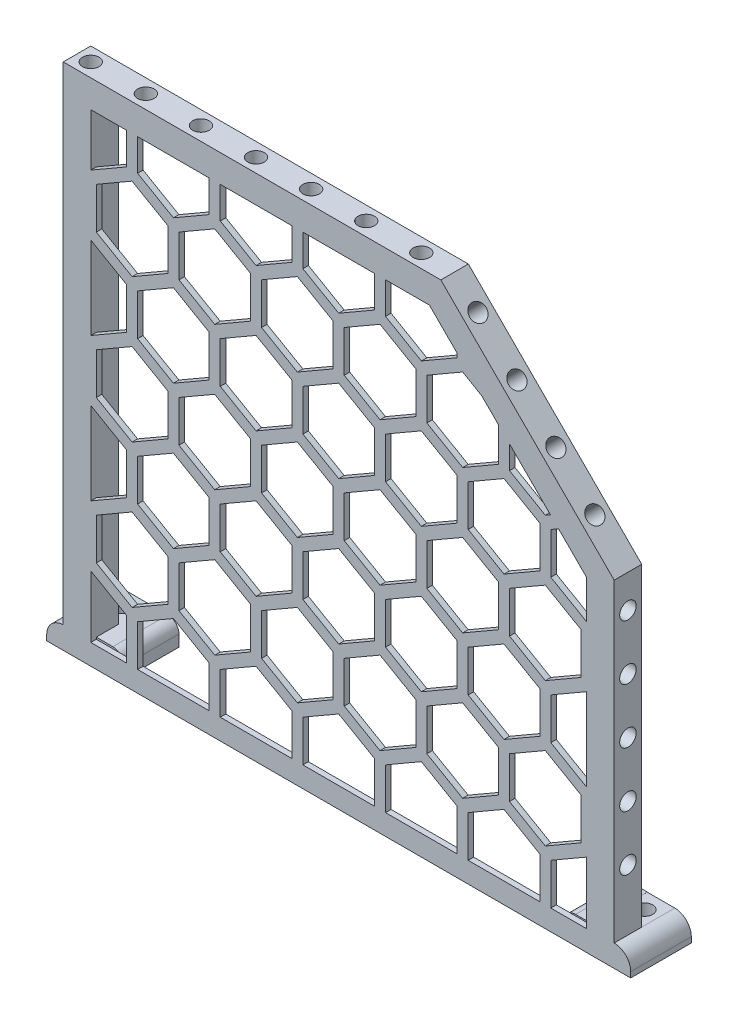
SolidWorks part; units mm, degrees
ref_plane "Plano frontal" through (0, 0, 0) normal (0, 0, 1) x (1, 0, 0)
ref_plane "Plano superior" through (0, 0, 0) normal (0, 1, 0) x (1, 0, 0)
ref_plane "Plano direito" through (0, 0, 0) normal (1, 0, 0) x (0, 0, -1)
sketch "Esboço1" plane through (0, 0, 0) normal (0, 0, 1) x (1, 0, 0)
  line L0 (-116.1394, 59.0665) -> (-116.1394, 68.5721)
  line L1 (-107.6394, 68.5721) -> (-94.6394, 68.5721)
  line L2 (-92.6394, 68.5721) -> (-79.6394, 68.5721)
  line L3 (-119.3883, -18.9279) -> (-24.3883, -18.9279) construction
  line L4 (-77.6394, 68.5721) -> (-64.6394, 68.5721)
  line L5 (-62.6394, 68.5721) -> (-54.6749, 68.5721)
  line L6 (-26.1394, 22.0777) -> (-26.1394, 7.0665)
  line L7 (-26.1394, -3.9223) -> (-26.1394, -15.1807)
  line L8 (-116.1394, -15.1807) -> (-116.1394, -3.9223)
  line L9 (-116.1394, 68.5721) -> (-109.6394, 68.5721)
  line L10 (-54.6749, 68.5721) -> (-49.6394, 63.5366)
  line L11 (-26.1394, 40.0366) -> (-26.1394, 33.0665)
  line L12 (-121.1394, -18.9279) -> (-121.1394, 73.5721)
  line L13 (-121.1394, 73.5721) -> (-52.6039, 73.5721)
  line L14 (-52.6039, 73.5721) -> (-21.1394, 42.1076)
  line L15 (-21.1394, 42.1076) -> (-21.1394, -18.9279)
  line L16 (-121.1394, -18.9279) -> (-116.1394, -18.9279)
  line L17 (-26.1394, -18.9279) -> (-21.1394, -18.9279)
  line L18 (-26.1394, -3.9223) -> (-26.1394, -15.1807)
  line L19 (-26.1394, -18.9279) -> (-26.1394, -18.9335)
  line L20 (-116.1394, 7.0665) -> (-116.1394, 22.0777)
  line L21 (-116.1394, 33.0665) -> (-116.1394, 48.0777)
  line L22 (-31.2372, 45.1344) -> (-26.1394, 40.0366)
  line L23 (-40.1394, 54.0366) -> (-32.7074, 46.6046)
  line L24 (-45.1876, 59.0847) -> (-42.1394, 56.0366)
  line L60 (-116.149, -18.9279) -> (-26.149, -18.9279)
  line L62 (-116.1394, 68.5721) -> (-109.6394, 68.5721)
  line L63 (-93.6394, -5.9335) -> (-87.1394, -2.1807)
  line L64 (-108.6394, -5.9335) -> (-102.1394, -2.1807)
  line L65 (-102.1394, -2.1807) -> (-102.1394, 5.3249)
  line L66 (-54.6749, 68.5721) -> (-49.6394, 63.5366)
  line L67 (-101.1394, 22.0777) -> (-107.6394, 18.3249)
  line L68 (-116.149, -18.9279) -> (-116.1394, -18.9335)
  line L69 (-26.1394, 40.0366) -> (-26.1394, 33.0665)
  line L70 (-26.1394, -18.9335) -> (-116.149, -18.9279)
  line L71 (-116.1394, 7.0665) -> (-109.6394, 10.8193)
  line L72 (-101.1394, -18.9335) -> (-101.1298, -18.9279)
  line L73 (-116.1394, -18.9335) -> (-116.1298, -18.9279)
  line L74 (-109.6394, -15.1807) -> (-109.6394, -7.6751)
  line L75 (-109.6394, -7.6751) -> (-116.1394, -3.9223)
  line L76 (-116.1394, -15.1807) -> (-109.6394, -15.1807)
  line L77 (-107.6394, -15.1807) -> (-94.6394, -15.1807)
  line L78 (-92.6394, -15.1807) -> (-79.6394, -15.1807)
  line L79 (-94.6394, -15.1807) -> (-94.6394, -7.6751)
  line L80 (-94.6394, -7.6751) -> (-101.1394, -3.9223)
  line L81 (-101.1394, -3.9223) -> (-107.6394, -7.6751)
  line L82 (-107.6394, -7.6751) -> (-107.6394, -15.1807)
  line L83 (-101.149, -18.9279) -> (-101.1394, -18.9335)
  line L84 (-86.1394, -18.9335) -> (-86.1298, -18.9279)
  line L85 (-79.6394, -15.1807) -> (-79.6394, -7.6751)
  line L86 (-79.6394, -7.6751) -> (-86.1394, -3.9223)
  line L87 (-86.1394, -3.9223) -> (-92.6394, -7.6751)
  line L88 (-92.6394, -7.6751) -> (-92.6394, -15.1807)
  line L89 (-86.149, -18.9279) -> (-86.1394, -18.9335)
  line L90 (-71.1394, -18.9335) -> (-71.1298, -18.9279)
  line L91 (-64.6394, -15.1807) -> (-64.6394, -7.6751)
  line L92 (-64.6394, -7.6751) -> (-71.1394, -3.9223)
  line L93 (-71.1394, -3.9223) -> (-77.6394, -7.6751)
  line L94 (-77.6394, -7.6751) -> (-77.6394, -15.1807)
  line L95 (-71.149, -18.9279) -> (-71.1394, -18.9335)
  line L96 (-56.1394, -18.9335) -> (-56.1298, -18.9279)
  line L97 (-49.6394, -15.1807) -> (-49.6394, -7.6751)
  line L98 (-49.6394, -7.6751) -> (-56.1394, -3.9223)
  line L99 (-56.1394, -3.9223) -> (-62.6394, -7.6751)
  line L100 (-62.6394, -7.6751) -> (-62.6394, -15.1807)
  line L101 (-56.149, -18.9279) -> (-56.1394, -18.9335)
  line L102 (-41.1394, -18.9335) -> (-41.1298, -18.9279)
  line L103 (-34.6394, -15.1807) -> (-34.6394, -7.6751)
  line L104 (-34.6394, -7.6751) -> (-41.1394, -3.9223)
  line L105 (-41.1394, -3.9223) -> (-47.6394, -7.6751)
  line L106 (-47.6394, -7.6751) -> (-47.6394, -15.1807)
  line L107 (-41.149, -18.9279) -> (-41.1394, -18.9335)
  line L108 (-26.1394, -18.9335) -> (-26.1298, -18.9279)
  line L109 (-77.6394, -15.1807) -> (-64.6394, -15.1807)
  line L110 (-62.6394, -15.1807) -> (-49.6394, -15.1807)
  line L111 (-26.1394, -3.9223) -> (-32.6394, -7.6751)
  line L112 (-32.6394, -7.6751) -> (-32.6394, -15.1807)
  line L113 (-26.149, -18.9279) -> (-26.1394, -18.9335)
  line L114 (-102.1394, 5.3249) -> (-108.6394, 9.0777)
  line L115 (-108.6394, 9.0777) -> (-115.1394, 5.3249)
  line L116 (-115.1394, 5.3249) -> (-115.1394, -2.1807)
  line L117 (-115.1394, -2.1807) -> (-108.6394, -5.9335)
  line L118 (-87.1394, -2.1807) -> (-87.1394, 5.3249)
  line L119 (-87.1394, 5.3249) -> (-93.6394, 9.0777)
  line L120 (-93.6394, 9.0777) -> (-100.1394, 5.3249)
  line L121 (-100.1394, 5.3249) -> (-100.1394, -2.1807)
  line L122 (-100.1394, -2.1807) -> (-93.6394, -5.9335)
  line L123 (-78.6394, -5.9335) -> (-72.1394, -2.1807)
  line L124 (-72.1394, -2.1807) -> (-72.1394, 5.3249)
  line L125 (-72.1394, 5.3249) -> (-78.6394, 9.0777)
  line L126 (-78.6394, 9.0777) -> (-85.1394, 5.3249)
  line L127 (-85.1394, 5.3249) -> (-85.1394, -2.1807)
  line L128 (-85.1394, -2.1807) -> (-78.6394, -5.9335)
  line L129 (-63.6394, -5.9335) -> (-57.1394, -2.1807)
  line L130 (-57.1394, -2.1807) -> (-57.1394, 5.3249)
  line L131 (-57.1394, 5.3249) -> (-63.6394, 9.0777)
  line L132 (-63.6394, 9.0777) -> (-70.1394, 5.3249)
  line L133 (-70.1394, 5.3249) -> (-70.1394, -2.1807)
  line L134 (-70.1394, -2.1807) -> (-63.6394, -5.9335)
  line L135 (-48.6394, -5.9335) -> (-42.1394, -2.1807)
  line L136 (-42.1394, -2.1807) -> (-42.1394, 5.3249)
  line L137 (-42.1394, 5.3249) -> (-48.6394, 9.0777)
  line L138 (-48.6394, 9.0777) -> (-55.1394, 5.3249)
  line L139 (-55.1394, 5.3249) -> (-55.1394, -2.1807)
  line L140 (-55.1394, -2.1807) -> (-48.6394, -5.9335)
  line L141 (-33.6394, -5.9335) -> (-27.1394, -2.1807)
  line L142 (-27.1394, -2.1807) -> (-27.1394, 5.3249)
  line L143 (-27.1394, 5.3249) -> (-33.6394, 9.0777)
  line L144 (-33.6394, 9.0777) -> (-40.1394, 5.3249)
  line L145 (-40.1394, 5.3249) -> (-40.1394, -2.1807)
  line L146 (-40.1394, -2.1807) -> (-33.6394, -5.9335)
  line L147 (-109.6394, 10.8193) -> (-109.6394, 18.3249)
  line L148 (-109.6394, 18.3249) -> (-116.1394, 22.0777)
  line L149 (-107.6394, 18.3249) -> (-107.6394, 10.8193)
  line L150 (-107.6394, 10.8193) -> (-101.1394, 7.0665)
  line L151 (-101.1394, 7.0665) -> (-94.6394, 10.8193)
  line L152 (-94.6394, 10.8193) -> (-94.6394, 18.3249)
  line L153 (-94.6394, 18.3249) -> (-101.1394, 22.0777)
  line L154 (-86.1394, 22.0777) -> (-92.6394, 18.3249)
  line L155 (-92.6394, 18.3249) -> (-92.6394, 10.8193)
  line L156 (-92.6394, 10.8193) -> (-86.1394, 7.0665)
  line L157 (-86.1394, 7.0665) -> (-79.6394, 10.8193)
  line L158 (-79.6394, 10.8193) -> (-79.6394, 18.3249)
  line L159 (-79.6394, 18.3249) -> (-86.1394, 22.0777)
  line L160 (-71.1394, 22.0777) -> (-77.6394, 18.3249)
  line L161 (-77.6394, 18.3249) -> (-77.6394, 10.8193)
  line L162 (-77.6394, 10.8193) -> (-71.1394, 7.0665)
  line L163 (-71.1394, 7.0665) -> (-64.6394, 10.8193)
  line L164 (-64.6394, 10.8193) -> (-64.6394, 18.3249)
  line L165 (-64.6394, 18.3249) -> (-71.1394, 22.0777)
  line L166 (-56.1394, 22.0777) -> (-62.6394, 18.3249)
  line L167 (-62.6394, 18.3249) -> (-62.6394, 10.8193)
  line L168 (-62.6394, 10.8193) -> (-56.1394, 7.0665)
  line L169 (-56.1394, 7.0665) -> (-49.6394, 10.8193)
  line L170 (-49.6394, 10.8193) -> (-49.6394, 18.3249)
  line L171 (-49.6394, 18.3249) -> (-56.1394, 22.0777)
  line L172 (-41.1394, 22.0777) -> (-47.6394, 18.3249)
  line L173 (-47.6394, 18.3249) -> (-47.6394, 10.8193)
  line L174 (-47.6394, 10.8193) -> (-41.1394, 7.0665)
  line L175 (-41.1394, 7.0665) -> (-34.6394, 10.8193)
  line L176 (-34.6394, 10.8193) -> (-34.6394, 18.3249)
  line L177 (-34.6394, 18.3249) -> (-41.1394, 22.0777)
  line L178 (-26.1394, 22.0777) -> (-32.6394, 18.3249)
  line L179 (-32.6394, 18.3249) -> (-32.6394, 10.8193)
  line L180 (-32.6394, 10.8193) -> (-26.1394, 7.0665)
  line L181 (-47.6394, -15.1807) -> (-34.6394, -15.1807)
  line L182 (-32.6394, -15.1807) -> (-26.1394, -15.1807)
  line L185 (-93.6394, 20.0665) -> (-87.1394, 23.8193)
  line L186 (-108.6394, 20.0665) -> (-102.1394, 23.8193)
  line L187 (-102.1394, 23.8193) -> (-102.1394, 31.3249)
  line L188 (-102.1394, 31.3249) -> (-108.6394, 35.0777)
  line L189 (-108.6394, 35.0777) -> (-115.1394, 31.3249)
  line L190 (-115.1394, 31.3249) -> (-115.1394, 23.8193)
  line L191 (-115.1394, 23.8193) -> (-108.6394, 20.0665)
  line L192 (-87.1394, 23.8193) -> (-87.1394, 31.3249)
  line L193 (-87.1394, 31.3249) -> (-93.6394, 35.0777)
  line L194 (-93.6394, 35.0777) -> (-100.1394, 31.3249)
  line L195 (-100.1394, 31.3249) -> (-100.1394, 23.8193)
  line L196 (-100.1394, 23.8193) -> (-93.6394, 20.0665)
  line L197 (-78.6394, 20.0665) -> (-72.1394, 23.8193)
  line L198 (-72.1394, 23.8193) -> (-72.1394, 31.3249)
  line L199 (-72.1394, 31.3249) -> (-78.6394, 35.0777)
  line L200 (-78.6394, 35.0777) -> (-85.1394, 31.3249)
  line L201 (-85.1394, 31.3249) -> (-85.1394, 23.8193)
  line L202 (-85.1394, 23.8193) -> (-78.6394, 20.0665)
  line L203 (-63.6394, 20.0665) -> (-57.1394, 23.8193)
  line L204 (-57.1394, 23.8193) -> (-57.1394, 31.3249)
  line L205 (-57.1394, 31.3249) -> (-63.6394, 35.0777)
  line L206 (-63.6394, 35.0777) -> (-70.1394, 31.3249)
  line L207 (-70.1394, 31.3249) -> (-70.1394, 23.8193)
  line L208 (-70.1394, 23.8193) -> (-63.6394, 20.0665)
  line L209 (-48.6394, 20.0665) -> (-42.1394, 23.8193)
  line L210 (-42.1394, 23.8193) -> (-42.1394, 31.3249)
  line L211 (-42.1394, 31.3249) -> (-48.6394, 35.0777)
  line L212 (-48.6394, 35.0777) -> (-55.1394, 31.3249)
  line L213 (-55.1394, 31.3249) -> (-55.1394, 23.8193)
  line L214 (-55.1394, 23.8193) -> (-48.6394, 20.0665)
  line L215 (-33.6394, 20.0665) -> (-27.1394, 23.8193)
  line L216 (-27.1394, 23.8193) -> (-27.1394, 31.3249)
  line L217 (-27.1394, 31.3249) -> (-33.6394, 35.0777)
  line L218 (-33.6394, 35.0777) -> (-40.1394, 31.3249)
  line L219 (-40.1394, 31.3249) -> (-40.1394, 23.8193)
  line L220 (-40.1394, 23.8193) -> (-33.6394, 20.0665)
  line L221 (-116.1394, 40.5721) -> (-109.6394, 40.5721) construction
  line L222 (-101.1394, 33.0665) -> (-94.6394, 36.8193)
  line L223 (-116.1394, 33.0665) -> (-109.6394, 36.8193)
  line L224 (-109.6394, 36.8193) -> (-109.6394, 44.3249)
  line L225 (-109.6394, 44.3249) -> (-116.1394, 48.0777)
  line L229 (-94.6394, 36.8193) -> (-94.6394, 44.3249)
  line L230 (-94.6394, 44.3249) -> (-101.1394, 48.0777)
  line L231 (-101.1394, 48.0777) -> (-107.6394, 44.3249)
  line L232 (-107.6394, 44.3249) -> (-107.6394, 36.8193)
  line L233 (-107.6394, 36.8193) -> (-101.1394, 33.0665)
  line L234 (-86.1394, 33.0665) -> (-79.6394, 36.8193)
  line L235 (-79.6394, 36.8193) -> (-79.6394, 44.3249)
  line L236 (-79.6394, 44.3249) -> (-86.1394, 48.0777)
  line L237 (-86.1394, 48.0777) -> (-92.6394, 44.3249)
  line L238 (-92.6394, 44.3249) -> (-92.6394, 36.8193)
  line L239 (-92.6394, 36.8193) -> (-86.1394, 33.0665)
  line L240 (-71.1394, 33.0665) -> (-64.6394, 36.8193)
  line L241 (-64.6394, 36.8193) -> (-64.6394, 44.3249)
  line L242 (-64.6394, 44.3249) -> (-71.1394, 48.0777)
  line L243 (-71.1394, 48.0777) -> (-77.6394, 44.3249)
  line L244 (-77.6394, 44.3249) -> (-77.6394, 36.8193)
  line L245 (-77.6394, 36.8193) -> (-71.1394, 33.0665)
  line L246 (-56.1394, 33.0665) -> (-49.6394, 36.8193)
  line L247 (-49.6394, 36.8193) -> (-49.6394, 44.3249)
  line L248 (-49.6394, 44.3249) -> (-56.1394, 48.0777)
  line L249 (-56.1394, 48.0777) -> (-62.6394, 44.3249)
  line L250 (-62.6394, 44.3249) -> (-62.6394, 36.8193)
  line L251 (-62.6394, 36.8193) -> (-56.1394, 33.0665)
  line L252 (-41.1394, 33.0665) -> (-34.6394, 36.8193)
  line L253 (-34.6394, 36.8193) -> (-34.6394, 44.3249)
  line L254 (-34.6394, 44.3249) -> (-41.1394, 48.0777)
  line L255 (-41.1394, 48.0777) -> (-47.6394, 44.3249)
  line L256 (-47.6394, 44.3249) -> (-47.6394, 36.8193)
  line L257 (-47.6394, 36.8193) -> (-41.1394, 33.0665)
  line L258 (-31.2372, 45.1344) -> (-26.1394, 40.0366)
  line L259 (-26.1394, 22.0777) -> (-26.1394, 7.0665)
  line L261 (-31.2372, 45.1344) -> (-32.6394, 44.3249)
  line L262 (-32.6394, 44.3249) -> (-32.6394, 36.8193)
  line L263 (-32.6394, 36.8193) -> (-26.1394, 33.0665)
  line L265 (-93.6394, 46.0665) -> (-87.1394, 49.8193)
  line L266 (-108.6394, 46.0665) -> (-102.1394, 49.8193)
  line L267 (-102.1394, 49.8193) -> (-102.1394, 57.3249)
  line L268 (-102.1394, 57.3249) -> (-108.6394, 61.0777)
  line L269 (-108.6394, 61.0777) -> (-115.1394, 57.3249)
  line L270 (-115.1394, 57.3249) -> (-115.1394, 49.8193)
  line L271 (-115.1394, 49.8193) -> (-108.6394, 46.0665)
  line L272 (-87.1394, 49.8193) -> (-87.1394, 57.3249)
  line L273 (-87.1394, 57.3249) -> (-93.6394, 61.0777)
  line L274 (-93.6394, 61.0777) -> (-100.1394, 57.3249)
  line L275 (-100.1394, 57.3249) -> (-100.1394, 49.8193)
  line L276 (-100.1394, 49.8193) -> (-93.6394, 46.0665)
  line L277 (-78.6394, 46.0665) -> (-72.1394, 49.8193)
  line L278 (-72.1394, 49.8193) -> (-72.1394, 57.3249)
  line L279 (-72.1394, 57.3249) -> (-78.6394, 61.0777)
  line L280 (-78.6394, 61.0777) -> (-85.1394, 57.3249)
  line L281 (-85.1394, 57.3249) -> (-85.1394, 49.8193)
  line L282 (-85.1394, 49.8193) -> (-78.6394, 46.0665)
  line L283 (-63.6394, 46.0665) -> (-57.1394, 49.8193)
  line L284 (-57.1394, 49.8193) -> (-57.1394, 57.3249)
  line L285 (-57.1394, 57.3249) -> (-63.6394, 61.0777)
  line L286 (-63.6394, 61.0777) -> (-70.1394, 57.3249)
  line L287 (-70.1394, 57.3249) -> (-70.1394, 49.8193)
  line L288 (-70.1394, 49.8193) -> (-63.6394, 46.0665)
  line L289 (-48.6394, 46.0665) -> (-42.1394, 49.8193)
  line L290 (-42.1394, 49.8193) -> (-42.1394, 56.0366)
  line L291 (-45.1876, 59.0847) -> (-48.6394, 61.0777)
  line L292 (-48.6394, 61.0777) -> (-55.1394, 57.3249)
  line L293 (-55.1394, 57.3249) -> (-55.1394, 49.8193)
  line L294 (-55.1394, 49.8193) -> (-48.6394, 46.0665)
  line L295 (-33.6394, 46.0665) -> (-32.7074, 46.6046)
  line L299 (-40.1394, 54.0366) -> (-40.1394, 49.8193)
  line L300 (-40.1394, 49.8193) -> (-33.6394, 46.0665)
  line L301 (-62.6394, 68.5721) -> (-54.6749, 68.5721)
  line L302 (-101.1394, 59.0665) -> (-94.6394, 62.8193)
  line L303 (-116.1394, 59.0665) -> (-109.6394, 62.8193)
  line L304 (-109.6394, 62.8193) -> (-109.6394, 68.5721)
  line L305 (-107.6394, 68.5721) -> (-94.6394, 68.5721)
  line L306 (-92.6394, 68.5721) -> (-79.6394, 68.5721)
  line L307 (-77.6394, 68.5721) -> (-64.6394, 68.5721)
  line L308 (-45.1876, 59.0847) -> (-42.1394, 56.0366)
  line L309 (-94.6394, 62.8193) -> (-94.6394, 68.5721)
  line L310 (-40.1394, 54.0366) -> (-32.7074, 46.6046)
  line L312 (-107.6394, 68.5721) -> (-107.6394, 62.8193)
  line L313 (-107.6394, 62.8193) -> (-101.1394, 59.0665)
  line L314 (-86.1394, 59.0665) -> (-79.6394, 62.8193)
  line L315 (-79.6394, 62.8193) -> (-79.6394, 68.5721)
  line L318 (-92.6394, 68.5721) -> (-92.6394, 62.8193)
  line L319 (-92.6394, 62.8193) -> (-86.1394, 59.0665)
  line L320 (-71.1394, 59.0665) -> (-64.6394, 62.8193)
  line L321 (-64.6394, 62.8193) -> (-64.6394, 68.5721)
  line L324 (-77.6394, 68.5721) -> (-77.6394, 62.8193)
  line L325 (-77.6394, 62.8193) -> (-71.1394, 59.0665)
  line L326 (-56.1394, 59.0665) -> (-49.6394, 62.8193)
  line L327 (-49.6394, 62.8193) -> (-49.6394, 63.5366)
  line L330 (-62.6394, 68.5721) -> (-62.6394, 62.8193)
  line L331 (-62.6394, 62.8193) -> (-56.1394, 59.0665)
  line L334 (-109.6394, 70.3249) -> (-112.8894, 72.2013)
  line L335 (-122.6394, 70.3249) -> (-122.6394, 62.8193)
  line L336 (-121.1394, 61.9533) -> (-119.3894, 60.9429)
  line L337 (-116.1394, 74.0777) -> (-117.015, 73.5721)
  line L338 (-33.6394, 61.0777) -> (-37.7412, 58.7095)
  line L339 (-27.1394, 57.3249) -> (-33.6394, 61.0777)
  line L340 (-27.1394, 49.8193) -> (-27.1394, 57.3249)
  line L341 (-19.6394, 44.3249) -> (-26.1394, 48.0777)
  line L342 (-19.6394, 36.8193) -> (-19.6394, 44.3249)
  line L343 (-26.1394, 33.0665) -> (-21.1394, 35.9533)
  line L344 (-19.6394, 10.8193) -> (-19.6394, 18.3249)
  line L345 (-21.1394, 9.9533) -> (-19.6394, 10.8193)
  line L346 (-19.6394, 18.3249) -> (-21.1394, 19.1909)
  line L347 (-122.6394, 44.3249) -> (-122.6394, 36.8193)
  line L348 (-122.6394, 36.8193) -> (-121.1394, 35.9533)
  line L349 (-119.3894, 46.2013) -> (-121.1394, 45.1909)
  line L350 (-121.1394, 19.1909) -> (-122.6394, 18.3249)
  line L351 (-122.6394, 14.5721) -> (-122.6394, 10.8193)
  line L352 (-121.1394, -6.8091) -> (-122.6394, -7.6751)
  line L353 (-122.6394, -11.4279) -> (-122.6394, -15.1807)
  line L354 (-121.1394, -16.0467) -> (-119.3894, -17.0571)
  line L355 (-122.6394, 10.8193) -> (-121.1394, 9.9533)
  line L356 (-19.6394, -15.1807) -> (-19.6394, -7.6751)
  line L357 (-19.6394, -7.6751) -> (-21.1394, -6.8091)
  point P4 (-108.6394, -18.9279)
  point P19 (-116.1394, -11.4279)
  point P68 (-123.6394, -18.9279)
  point P69 (-116.1394, 1.5721)
  point P71 (-116.1394, -11.4279)
  point P75 (-108.6394, 14.5721)
  point P82 (-108.6394, 1.5721)
  point P84 (-116.1394, 14.5721)
  point P204 (-108.6394, 27.5721)
  point P207 (-116.1394, 27.5721)
  point P245 (-116.1394, 40.5721)
  point P248 (-108.6394, 40.5721)
  point P292 (-108.6394, 53.5721)
  point P295 (-108.6394, 66.5721)
  point P335 (-116.1394, 66.5721)
  dimension "D2" = 7.5
  dimension "D3" = 15
  dimension "D4" = 13
  dimension "D7" = 7.5
  dimension "D8" = 7
  dimension "D9" = 13
  dimension "D10" = 13
  dimension "D11" = 13
  dimension "D12" = 6
  dimension "D6" = 13
  dimension "D5" = 13
extrude "Ressalto-extrusão2" add sketch "Esboço1" along normal blind 1 contours L60 L113 L19 L17 L15 L14 L13 L12 L16 L70 L331 L330 L5 L10 L327 L326 L325 L324 L4 L321 L320 L319 L318 L2 L315 L314 L313 L312 L1 L309 L302 L304 L303 L0
sketch "Esboço2" plane through (0, 0, 1) normal (0, 0, 1) x (1, 0, 0)
  line L0 (-116.1394, 68.5721) -> (-54.6749, 68.5721)
  line L1 (-54.6749, 68.5721) -> (-26.1394, 40.0366)
  line L2 (-26.1394, 40.0366) -> (-26.1394, -18.9335)
  line L3 (-26.1394, -18.9335) -> (-21.1394, -18.9279)
  line L4 (-21.1394, -18.9279) -> (-21.1394, 42.1076)
  line L5 (-21.1394, 42.1076) -> (-52.6039, 73.5721)
  line L6 (-52.6039, 73.5721) -> (-121.1394, 73.5721)
  line L7 (-121.1394, 73.5721) -> (-121.1394, -18.9279)
  line L8 (-121.1394, -18.9279) -> (-116.1394, -18.9279)
  line L9 (-116.1394, -18.9279) -> (-116.1394, 68.5721)
extrude "Ressalto-extrusão10" add sketch "Esboço2" against normal blind 5 contours L7 L8 L9 L0 L1 L2 L3 L4 L5 L6
sketch "Esboço3" plane through (0, 0, -4) normal (0, 0, -1) x (-1, 0, 0)
  line L0 (21.1394, -18.9279) -> (21.1394, 42.1076) construction
  line L1 (26.149, -18.9279) -> (21.1394, -18.9279)
  line L2 (26.149, -18.9279) -> (26.149, -14.9298)
  line L3 (26.149, -14.9298) -> (21.1394, -14.9298)
  line L4 (21.1394, -18.9279) -> (21.1394, -14.9298)
extrude "Ressalto-extrusão11" add sketch "Esboço3" along normal blind 6
sketch "Esboço4" plane through (0, 0, -4) normal (0, 0, -1) x (-1, 0, 0)
  line L0 (116.1394, -18.9279) -> (116.1394, 68.5721) construction
  line L1 (121.1394, -18.9279) -> (116.1394, -18.9279)
  line L2 (121.1394, -18.9279) -> (121.1394, -14.8482)
  line L3 (121.1394, -14.8482) -> (116.1394, -14.8482)
  line L4 (116.1394, -18.9279) -> (116.1394, -14.8482)
extrude "Ressalto-extrusão12" add sketch "Esboço4" along normal blind 6
sketch "Esboço5" plane through (0, -14.8482, 0) normal (0, 1, 0) x (1, 0, 0)
  circle A0 centre (-118.6394, 7) radius 1.5
  point P0 (-118.6394, 7)
  dimension "D1" = 3
extrude "Corte-extrusão1" cut sketch "Esboço5" against normal blind 6
sketch "Esboço6" plane through (0, -14.9298, 0) normal (0, 1, 0) x (1, 0, 0)
  line L0 (-26.149, 10) -> (-26.149, 4) construction
  circle A0 centre (-23.6442, 7) radius 1.5
  point P0 (-26.149, 7)
  point P1 (-23.6442, 7)
  dimension "D1" = 3
extrude "Corte-extrusão2" cut sketch "Esboço6" against normal blind 6
sketch "Esboço7" plane through (0, 73.5721, 0) normal (0, 1, 0) x (1, 0, 0)
  circle A0 centre (-118.6394, 1.5) radius 1.5
  circle A1 centre (-108.6394, 1.5) radius 1.5
  circle A2 centre (-98.6394, 1.5) radius 1.5
  circle A3 centre (-88.6394, 1.5) radius 1.5
  circle A4 centre (-78.6394, 1.5) radius 1.5
  circle A5 centre (-68.6394, 1.5) radius 1.5
  circle A6 centre (-58.6394, 1.5) radius 1.5
  point P6 (-118.6394, 1.5)
  dimension "D2" = 3
  dimension "D1" = 7
extrude "Corte-extrusão3" cut sketch "Esboço7" against normal blind 6 contours A0 | A1 | A2 | A3 | A4 | A5 | A6
sketch "Esboço8" plane through (10.4841, 10.4841, 0) normal (0.7071, 0.7071, 0) x (0, 0, -1)
  circle A0 centre (1.5, 83.2199) radius 1.5
  circle A1 centre (1.5, 73.2199) radius 1.5
  circle A2 centre (1.5, 63.2199) radius 1.5
  circle A3 centre (1.5, 53.2199) radius 1.5
  point P6 (1.5, 83.2199)
  dimension "D2" = 3
  dimension "D1" = 4
extrude "Corte-extrusão5" cut sketch "Esboço8" against normal blind 6 contours A3 | A2 | A1 | A0
sketch "Esboço9" plane through (-21.1394, 0, 0) normal (1, 0, 0) x (0, 0, -1)
  line L0 (-1, 42.1076) -> (4, 42.1076) construction
  circle A0 centre (1.5, 36.1076) radius 1.5
  circle A1 centre (1.5, 26.1076) radius 1.5
  circle A2 centre (1.5, 16.1076) radius 1.5
  circle A3 centre (1.5, 6.1076) radius 1.5
  circle A4 centre (1.5, -3.8924) radius 1.5
  point P0 (1.5, 42.1076)
  point P1 (1.5, 36.1076)
  dimension "D2" = 3
  dimension "D1" = 6
extrude "Corte-extrusão6" cut sketch "Esboço9" against normal blind 6
sketch "Esboço10" plane through (-21.1394, 0, 0) normal (1, 0, 0) x (0, 0, -1)
  line L1 (10, -14.9298) -> (-1, -14.9298)
  line L2 (10, -14.9298) -> (10, -18.9279)
  line L3 (10, -18.9279) -> (-1, -18.9279)
  line L4 (-1, -14.9298) -> (-1, -18.9279)
extrude "Ressalto-extrusão13" add sketch "Esboço10" along normal blind 3
fillet "Filete1" radius 3 1 edges at (-18.1394, -14.9298, -4.5)
sketch "Esboço11" plane through (-121.1394, 0, 0) normal (-1, 0, 0) x (0, 0, 1)
  line L1 (-10, -18.9279) -> (1, -18.9279)
  line L2 (-10, -18.9279) -> (-10, -14.9298)
  line L3 (-10, -14.9298) -> (1, -14.9298)
  line L4 (1, -18.9279) -> (1, -14.9298)
extrude "Ressalto-extrusão14" add sketch "Esboço11" along normal blind 3
fillet "Filete2" radius 3 1 edges at (-124.1394, -14.9298, -4.5)
sketch "Esboço12" plane through (-26.1394, 0, 0) normal (-1, 0, 0) x (0, 0, 1)
  line L1 (0, -18.9335) -> (-10.029, -18.9335)
  line L2 (0, -18.9335) -> (0, -14.9264)
  line L3 (0, -14.9264) -> (-10.029, -14.9264)
  line L4 (-10.029, -18.9335) -> (-10.029, -14.9264)
extrude "Ressalto-extrusão15" add sketch "Esboço12" along normal blind 5
fillet "Filete3" radius 2 1 edges at (-31.1394, -14.9264, -5.0145)
sketch "Esboço13" plane through (-116.1394, 0, 0) normal (1, 0, 0) x (0, 0, -1)
  line L1 (10, -14.8482) -> (0, -14.8482)
  line L2 (10, -14.8482) -> (10, -18.9279)
  line L3 (10, -18.9279) -> (0, -18.9279)
  line L4 (0, -14.8482) -> (0, -18.9279)
extrude "Ressalto-extrusão16" add sketch "Esboço13" along normal blind 5
fillet "Filete4" radius 2 1 edges at (-111.1394, -14.8482, -5)
